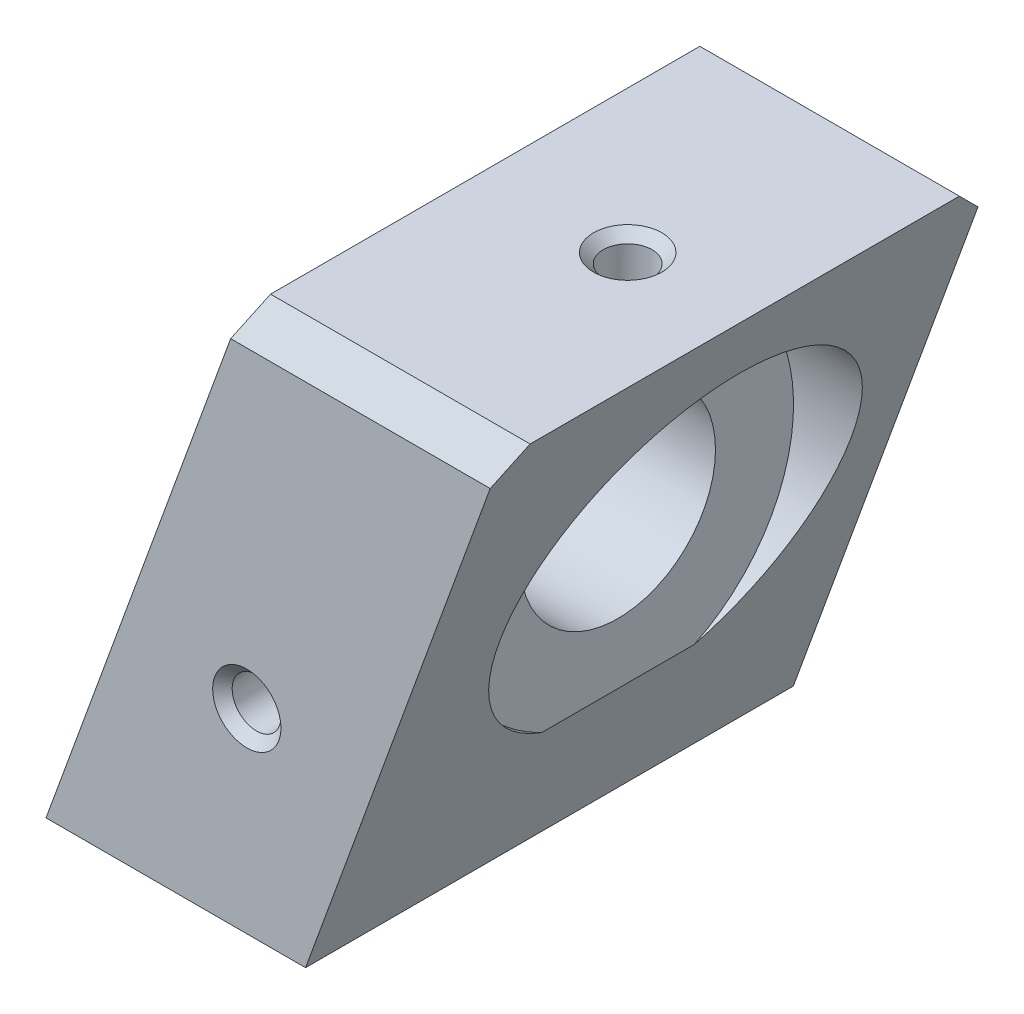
SolidWorks part; units mm, degrees
ref_plane "Plan de face" through (0, 0, 0) normal (0, 0, 1) x (1, 0, 0)
ref_plane "Plan de dessus" through (0, 0, 0) normal (0, 1, 0) x (1, 0, 0)
ref_plane "Plan de droite" through (0, 0, 0) normal (1, 0, 0) x (0, 0, -1)
sketch "Esquisse1" plane through (0, 0, 0) normal (0, 0, 1) x (1, 0, 0)
  line L0 (0, 0) -> (26.6044, 0)
  line L1 (0, 0) -> (20.0184, 55)
  line L2 (20.0184, 55) -> (46.6228, 55)
  line L3 (46.6228, 55) -> (26.6044, 0)
  dimension "D1" = 55
  dimension "D2" = 25
  dimension "D3" = 70
extrude "Extrusion1" add sketch "Esquisse1" along normal mid plane 50
hole_wizard "Diamètre du perçage Ø8.5 (8.5)1" positions "Esquisse3" profile "Esquisse2" hole size "Ø8.5" standard "ISO"
sketch "Esquisse3" plane through (0, 0, 0) normal (0, -1, 0) x (1, 0, 0)
  line L0 (15, -26.0602) -> (15, 27.7722) construction
  line L2 (0, 25) -> (0, -25) construction
  line L3 (0, -25) -> (26.6044, -25) construction
  point P0 (15, 13.6)
  point P12 (15, -16.4)
  dimension "D1" = 15
  dimension "D2" = 30
  dimension "D3" = 8.6
sketch "Esquisse2" plane through (15, 0, 13.6) normal (1, 0, 0) x (0, 0, -1)
  line L0 (0, 0) -> (0, 27.0537)
  line L1 (0, 27.0537) -> (4.25, 24.5)
  line L2 (4.25, 24.5) -> (4.25, 0)
  line L5 (4.25, 0) -> (0, 0)
  line L10 (0, 27.0537) -> (-4.25, 24.5) construction
  line L11 (0, -6.35) -> (0, 107.95) construction
  dimension "Diamètre du perçage" = 8.5
  dimension "Profondeur du perçage" = 24.5
  dimension "Angle de pointe" = 118
chamfer "Chanfrein1" distance 1 angle 45 2 edges at (15, 0, -20.65) (15, 0, 9.35)
ref_plane "Plan1" through (0, 0, -2) normal (0, 0, 1) x (1, 0, 0)
sketch "Esquisse4" plane through (0, 0, -2) normal (0, 0, 1) x (1, 0, 0)
  line L0 (-32.8467, 30) -> (60.3937, 30) construction
  line L1 (0, 0) -> (26.6044, 0) construction
  line L2 (0, 30) -> (0, 12)
  line L3 (0, 12) -> (17, 12)
  line L4 (17, 12) -> (17, 20)
  line L5 (17, 20) -> (31.6228, 20)
  line L6 (31.6228, 20) -> (31.6228, 12)
  line L7 (31.6228, 12) -> (46.6228, 12)
  line L8 (46.6228, 12) -> (46.6228, 30)
  line L9 (0, 30) -> (46.6228, 30)
  dimension "D1" = 30
  dimension "D2" = 17
  dimension "D3" = 15
  dimension "D4" = 20
  dimension "D5" = 36
revolve "Enlèvement de matière-Révolution1" cut sketch "Esquisse4" angle 360 about L0
chamfer "Chanfrein2" distance 3 angle 45 2 edges at (33.3206, 55, -25) (33.3206, 55, 25)
hole_wizard "Diamètre du perçage Ø5.0 (5)1" positions "Esquisse6" profile "Esquisse5" hole size "Ø5.0" standard "ISO"
sketch "Esquisse6" plane through (0, 0, 25) normal (0, 0, 1) x (1, 0, 0)
  line L0 (33.3206, 55) -> (13.3022, 0) construction
  line L1 (20.0184, 55) -> (46.6228, 55) construction
  line L2 (0, 0) -> (26.6044, 0) construction
  point P0 (20.5816, 20)
  dimension "D1" = 35
sketch "Esquisse5" plane through (20.5816, 20, 25) normal (1, 0, 0) x (0, -1, 0)
  line L0 (0, 0) -> (0, 16.5022)
  line L1 (0, 16.5022) -> (2.5, 15)
  line L2 (2.5, 15) -> (2.5, 0)
  line L5 (2.5, 0) -> (0, 0)
  line L10 (0, 16.5022) -> (-2.5, 15) construction
  line L11 (0, -6.35) -> (0, 107.95) construction
  dimension "Diamètre du perçage" = 5
  dimension "Profondeur du perçage" = 15
  dimension "Angle de pointe" = 118
chamfer "Chanfrein3" distance 1 angle 45 1 edges at (23.0816, 20, 25)
hole_wizard "Diamètre du perçage Ø5.0 (5)2" positions "Esquisse8" profile "Esquisse7" hole size "Ø5.0" standard "ISO"
sketch "Esquisse8" plane through (0, 0, -25) normal (0, 0, -1) x (-1, 0, 0)
  circle A0 centre (-20.5816, 20) radius 3.5 construction
  point P0 (-20.5816, 20)
sketch "Esquisse7" plane through (20.5816, 20, -25) normal (1, 0, 0) x (0, 1, 0)
  line L0 (0, 0) -> (0, 16.5022)
  line L1 (0, 16.5022) -> (2.5, 15)
  line L2 (2.5, 15) -> (2.5, 0)
  line L5 (2.5, 0) -> (0, 0)
  line L10 (0, 16.5022) -> (-2.5, 15) construction
  line L11 (0, -6.35) -> (0, 107.95) construction
  dimension "Diamètre du perçage" = 5
  dimension "Profondeur du perçage" = 15
  dimension "Angle de pointe" = 118
chamfer "Chanfrein4" distance 1 angle 45 1 edges at (18.0816, 20, -25)
hole_wizard "Diamètre du perçage Ø5.0 (5)3" positions "Esquisse10" profile "Esquisse9" hole size "Ø5.0" standard "ISO"
sketch "Esquisse10" plane through (0, 55, 0) normal (0, 1, 0) x (-1, 0, 0)
  line L0 (0, 0) -> (-53.8031, 0) construction
  line L1 (-46.6228, 22) -> (-46.6228, -22) construction
  point P0 (-34.6228, 0)
  dimension "D1" = 12
sketch "Esquisse9" plane through (34.6228, 55, 0) normal (1, 0, 0) x (0, 0, 1)
  line L0 (0, 0) -> (0, 16.5022)
  line L1 (0, 16.5022) -> (2.5, 15)
  line L2 (2.5, 15) -> (2.5, 0)
  line L5 (2.5, 0) -> (0, 0)
  line L10 (0, 16.5022) -> (-2.5, 15) construction
  line L11 (0, -6.35) -> (0, 107.95) construction
  dimension "Diamètre du perçage" = 5
  dimension "Profondeur du perçage" = 15
  dimension "Angle de pointe" = 118
chamfer "Chanfrein5" distance 1 angle 45 1 edges at (34.6228, 55, 2.5)
sketch "Esquisse11" plane through (0, 0, 0) normal (0, -1, 0) x (1, 0, 0)
  line L0 (25.042, -2) -> (-25.042, -2) construction
  line L1 (0, 25) -> (0, -25) construction
  circle A0 centre (8, -2) radius 4.25
  dimension "D1" = 8.5
  dimension "D2" = 8
extrude "Extrusion2" cut sketch "Esquisse11" against normal through all
thread "Filetage1" pitch 1.5 start angle 0, offset 3, length 23, pitch 1.5, diameter 8.5
ref_plane "Plan2" through (19.25, -2, 13.6) normal (0, 0, 1) x (1, 0, 0)
sketch "Profil de filetage1" plane through (19.25, -2, 13.6) normal (0, 0, 1) x (1, 0, 0)
  line L0 (0, 0) -> (0, 1.5) construction
  line L1 (0, 0) -> (0.8119, 0.4687)
  line L2 (0.8119, 0.4687) -> (0.8119, 0.6562)
  line L3 (0.8119, 0.6562) -> (0, 1.125)
  line L4 (0.8119, 0.5625) -> (0, 0.5625) construction
  line L11 (0, 0) -> (0, 1.125)
  point P2 (0, 0)
  dimension "Pitch" = 1.5
  dimension "Profile_Angle" = 60
  dimension "Profile_Land" = 0.1875
  dimension "Profile_Height" = 0.8119
thread "Filetage2" pitch 1.5 start angle 0, offset 3, length 23, pitch 1.5, diameter 8.5
ref_plane "Plan3" through (19.25, -2, -16.4) normal (0, 0, 1) x (1, 0, 0)
sketch "Profil de filetage2" plane through (19.25, -2, -16.4) normal (0, 0, 1) x (1, 0, 0)
  line L0 (0, 0) -> (0, 1.5) construction
  line L1 (0, 0) -> (0.8119, 0.4687)
  line L2 (0.8119, 0.4687) -> (0.8119, 0.6562)
  line L3 (0.8119, 0.6562) -> (0, 1.125)
  line L4 (0.8119, 0.5625) -> (0, 0.5625) construction
  line L11 (0, 0) -> (0, 1.125)
  point P2 (0, 0)
  dimension "Pitch" = 1.5
  dimension "Profile_Angle" = 60
  dimension "Profile_Land" = 0.1875
  dimension "Profile_Height" = 0.8119
thread "Filetage3" pitch 1 start angle 0, offset 3, length 13, pitch 1, diameter 5
ref_plane "Plan4" through (18.0816, 20, 27) normal (0, -1, 0) x (-1, 0, 0)
sketch "Profil de filetage3" plane through (18.0816, 20, 27) normal (0, -1, 0) x (-1, 0, 0)
  line L0 (0, 0) -> (0, 1) construction
  line L1 (0, 0) -> (0.5413, 0.3125)
  line L2 (0.5413, 0.3125) -> (0.5413, 0.4375)
  line L3 (0.5413, 0.4375) -> (0, 0.75)
  line L4 (0.5413, 0.375) -> (0, 0.375) construction
  line L11 (0, 0) -> (0, 0.75)
  point P2 (0, 0)
  dimension "Pitch" = 1
  dimension "Profile_Angle" = 60
  dimension "Profile_Land" = 0.125
  dimension "Profile_Height" = 0.5413
thread "Filetage4" pitch 1 start angle 0, offset 3, length 13, pitch 1, diameter 5
ref_plane "Plan5" through (23.0816, 20, -27) normal (0, -1, 0) x (1, 0, 0)
sketch "Profil de filetage4" plane through (23.0816, 20, -27) normal (0, -1, 0) x (1, 0, 0)
  line L0 (0, 0) -> (0, 1) construction
  line L1 (0, 0) -> (0.5413, 0.3125)
  line L2 (0.5413, 0.3125) -> (0.5413, 0.4375)
  line L3 (0.5413, 0.4375) -> (0, 0.75)
  line L4 (0.5413, 0.375) -> (0, 0.375) construction
  line L11 (0, 0) -> (0, 0.75)
  point P2 (0, 0)
  dimension "Pitch" = 1
  dimension "Profile_Angle" = 60
  dimension "Profile_Land" = 0.125
  dimension "Profile_Height" = 0.5413
thread "Filetage5" pitch 1 start angle 0, offset 3, length 9, pitch 1, diameter 5
ref_plane "Plan6" through (32.1228, 57, 0) normal (0, 0, 1) x (-1, 0, 0)
sketch "Profil de filetage5" plane through (32.1228, 57, 0) normal (0, 0, 1) x (-1, 0, 0)
  line L0 (0, 0) -> (0, 1) construction
  line L1 (0, 0) -> (0.5413, 0.3125)
  line L2 (0.5413, 0.3125) -> (0.5413, 0.4375)
  line L3 (0.5413, 0.4375) -> (0, 0.75)
  line L4 (0.5413, 0.375) -> (0, 0.375) construction
  line L11 (0, 0) -> (0, 0.75)
  point P2 (0, 0)
  dimension "Pitch" = 1
  dimension "Profile_Angle" = 60
  dimension "Profile_Land" = 0.125
  dimension "Profile_Height" = 0.5413
